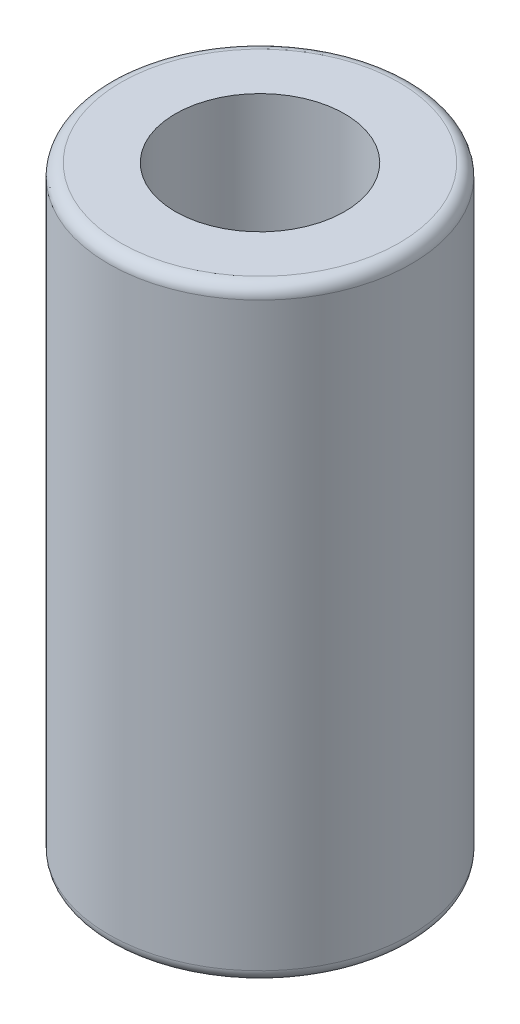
SolidWorks part; units mm, degrees
ref_plane "Front Plane" through (0, 0, 0) normal (0, 0, 1) x (1, 0, 0)
ref_plane "Top Plane" through (0, 0, 0) normal (0, 1, 0) x (1, 0, 0)
ref_plane "Right Plane" through (0, 0, 0) normal (1, 0, 0) x (0, 0, -1)
sketch "Sketch1" plane through (0, 0, 0) normal (0, 1, 0) x (1, 0, 0)
  circle A0 centre (0, 0) radius 1.778
  circle A1 centre (0, 0) radius 3.175
  dimension "D1" = 3.556
  dimension "D2" = 6.35
extrude "Boss-Extrude1" add sketch "Sketch1" along normal blind 12.7
fillet "Fillet1" radius 0.254 2 edges at (0, 0, 3.175) (0, 12.7, 3.175)
equation "\"Buoyancy\"=\"SW-Volume\"*(\"SW-Density\"-.037062)"
